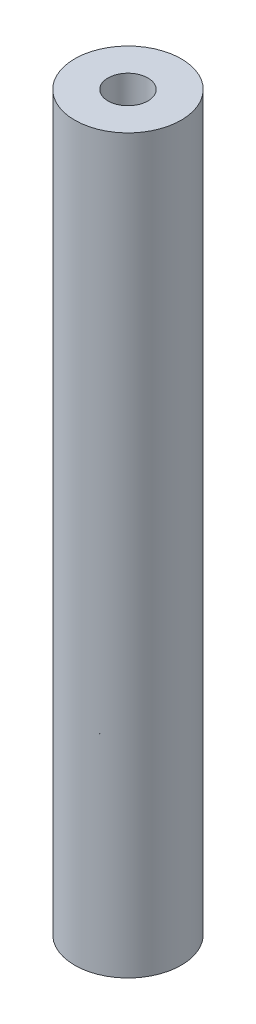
SolidWorks part; units mm, degrees
ref_plane "Спереди" through (0, 0, 0) normal (0, 0, 1) x (1, 0, 0)
ref_plane "Сверху" through (0, 0, 0) normal (0, 1, 0) x (1, 0, 0)
ref_plane "Справа" through (0, 0, 0) normal (1, 0, 0) x (0, 0, -1)
sketch "Эскиз1" plane through (0, 0, 0) normal (0, 1, 0) x (1, 0, 0)
  circle A0 centre (0, 0) radius 4
extrude "Бобышка-Вытянуть1" add sketch "Эскиз1" along normal blind 55
sketch "Эскиз2" plane through (0, 0, 0) normal (0, -1, 0) x (1, 0, 0)
  circle A0 centre (0, 0) radius 1.5
extrude "Вырез-Вытянуть1" cut sketch "Эскиз2" against normal up to surface (55 mm away)
